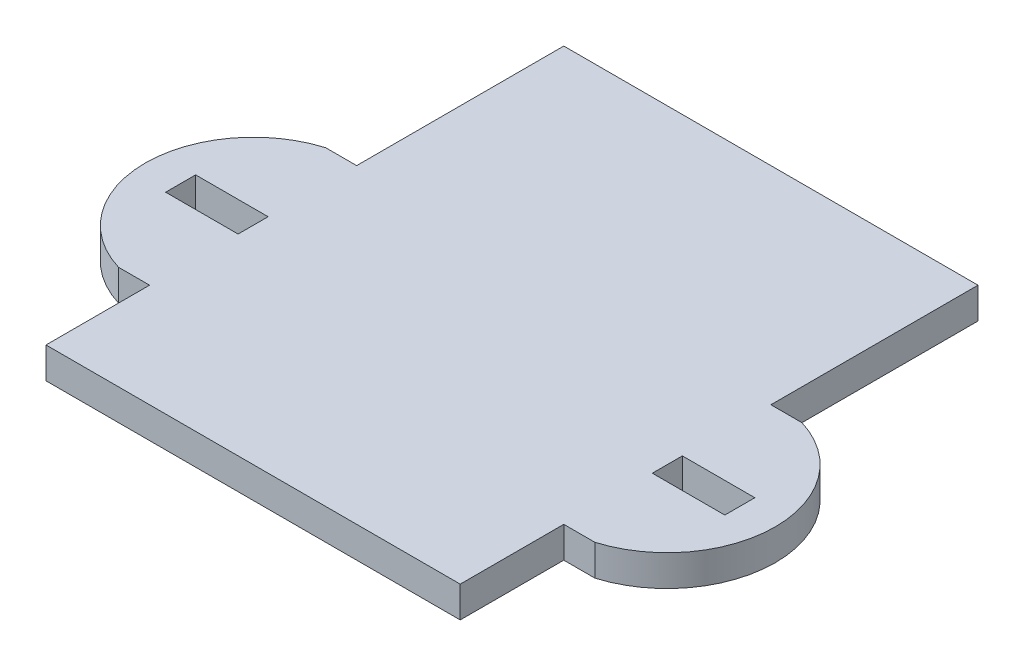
SolidWorks part; units mm, degrees
ref_plane "Plan de face" through (0, 0, 0) normal (0, 0, 1) x (1, 0, 0)
ref_plane "Plan de dessus" through (0, 0, 0) normal (0, 1, 0) x (1, 0, 0)
ref_plane "Plan de droite" through (0, 0, 0) normal (1, 0, 0) x (0, 0, -1)
sketch "Esquisse1" plane through (0, 0, 0) normal (0, 1, 0) x (1, 0, 0)
  line L0 (-30.2924, -5) -> (4, -5) construction
  line L1 (-20, -25) -> (20, -25)
  line L2 (-20, -25) -> (-20, -15)
  line L3 (-20, 25) -> (20, 25)
  line L4 (20, -25) -> (20, -15)
  line L5 (-20, -6.45) -> (-20, -3.55)
  line L6 (-20, 25) -> (20, -25) construction
  line L7 (-27, -3.55) -> (-20, -3.55)
  line L8 (-27, -3.55) -> (-27, -6.45)
  line L9 (-27, -6.45) -> (-20, -6.45)
  line L11 (-27, -3.55) -> (-20, -6.45) construction
  line L12 (-27, -6.45) -> (-20, -3.55) construction
  line L13 (-23, -15) -> (-20, -15)
  line L15 (-23, 5) -> (-20, 5)
  line L17 (-23, -15) -> (-17, 5) construction
  line L18 (-23, 5) -> (-17, -15) construction
  line L19 (-20, 5) -> (-20, 25)
  line L20 (-30.2924, -5) -> (-44.8894, -5) construction
  line L21 (-22.9821, -5) -> (-22.9795, -4.7844)
  line L22 (0, 0) -> (0, 9.8489) construction
  line L23 (20, -6.45) -> (20, -3.55)
  line L24 (27, -3.55) -> (20, -3.55)
  line L25 (27, -6.45) -> (20, -6.45)
  line L26 (27, -3.55) -> (27, -6.45)
  line L27 (23, -15) -> (20, -15)
  line L28 (23, 5) -> (20, 5)
  line L29 (20, 5) -> (20, 25)
  arc A0 (-23, 5) -> (-23, -15) centre (-19.9782, -5) ccw
  arc A1 (23, 5) -> (23, -15) centre (19.9782, -5) cw
  point P0 (0, 0)
  point P8 (-23.5, -5)
  point P9 (-20, -5)
  point P10 (-23.5, -5)
  point P15 (-20, -5)
  point P22 (-36, -5)
  dimension "D1" = 40
  dimension "D2" = 50
  dimension "D3" = 30
  dimension "D4" = 3.5
  dimension "D5" = 2.9
  dimension "D6" = 6
  dimension "D7" = 20
extrude "Boss.-Extru.1" add sketch "Esquisse1" along normal blind 3 contours A1 L28 L29 L3 L19 L15 A0 L13 L2 L1 L4 L27 L9 L8 L7 L5 L24 L26 L25 L23
